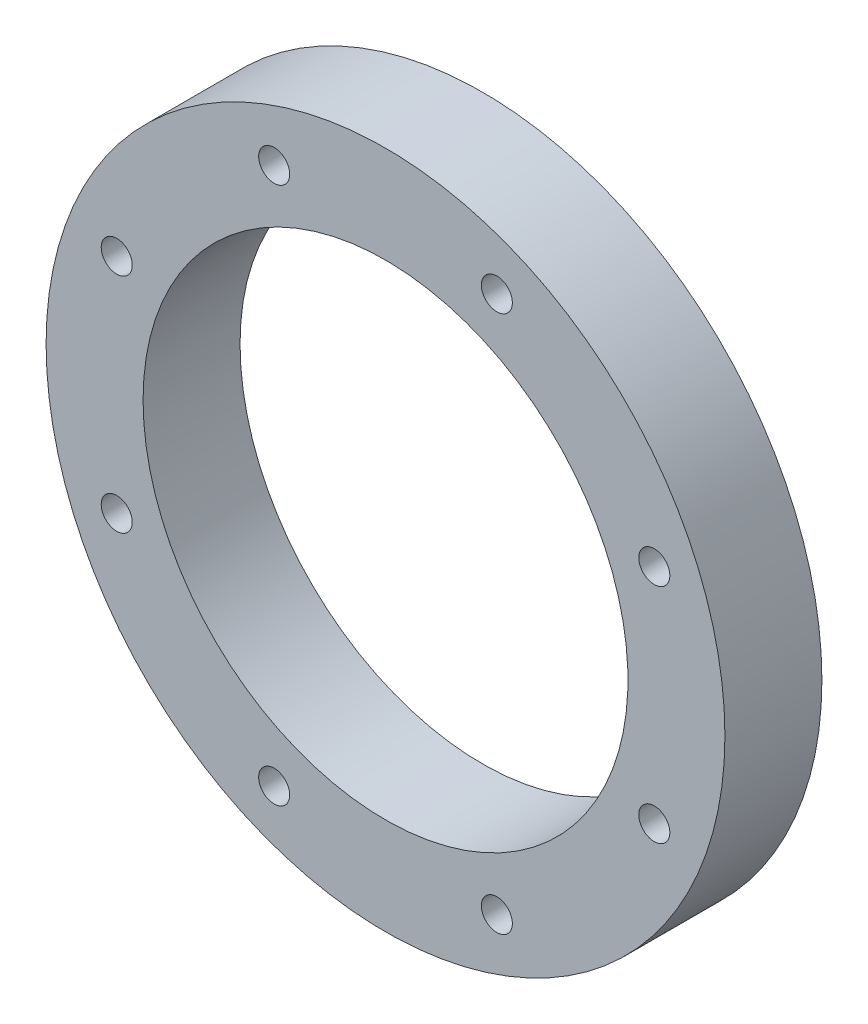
SolidWorks part; units mm, degrees
ref_plane "Front Plane" through (0, 0, 0) normal (0, 0, 1) x (1, 0, 0)
ref_plane "Top Plane" through (0, 0, 0) normal (0, 1, 0) x (1, 0, 0)
ref_plane "Right Plane" through (0, 0, 0) normal (1, 0, 0) x (0, 0, -1)
sketch "Sketch2" plane through (0, 0, 0) normal (0, 0, 1) x (1, 0, 0)
  circle A0 centre (0, 0) radius 35
extrude "Boss-Extrude1" add sketch "Sketch2" against normal blind 10
sketch "Sketch3" plane through (0, 0, -10) normal (0, 0, -1) x (-1, 0, 0)
  circle A0 centre (0, 0) radius 25
extrude "Cut-Extrude1" cut sketch "Sketch3" against normal blind 10
sketch "Sketch6" plane through (0, 0, 0) normal (1, 0, 0) x (0, 0, -1)
  line L0 (10, 35) -> (0, 35) construction
  line L1 (6, 36) -> (4, 36)
  line L2 (6, 36) -> (6, 34)
  line L3 (6, 34) -> (4, 34)
  line L4 (4, 36) -> (4, 34)
  line L5 (6, 36) -> (4, 34) construction
  line L6 (6, 34) -> (4, 36) construction
  point P0 (5, 35)
  dimension "D1" = 2
  dimension "D2" = 2
ref_plane "Plane1" through (0, 0, -5) normal (0, 0, 1) x (1, 0, 0)
ref_plane "Plane2" through (0, 0, -10) normal (0, 0, -1) x (-1, 0, 0)
hole_wizard "CBORE for M3 SHCS2" positions "Sketch11" profile "Sketch10" counterbore size "M3" standard "Ansi Metric"
sketch "Sketch11" plane through (0, 0, -10) normal (0, 0, -1) x (-1, 0, 0)
  point P1 (11.4805, 27.7164)
  dimension "D1" = 30
  dimension "D2" = 11.4805
sketch "Sketch10" plane through (-11.4805, 27.7164, -10) normal (1, 0, 0) x (0, 1, 0)
  line L0 (0, 0) -> (0, 10)
  line L1 (0, 10) -> (1.6, 10)
  line L3 (1.6, 10) -> (1.6, 4)
  line L4 (1.6, 4) -> (3.25, 4)
  line L5 (3.25, 4) -> (3.25, 0)
  line L7 (3.25, 0) -> (0, 0)
  line L11 (0, -6.35) -> (0, 107.95) construction
  dimension "Thru Hole Dia." = 3.2
  dimension "Thru Hole Depth" = 10
  dimension "C'Bore Dia." = 6.5
  dimension "C'Bore Depth" = 4
pattern_circular "CirPattern1" count 8 over 360 about axis through (0, 0, 0) along (0, 0, 1) of "CBORE for M3 SHCS2"
